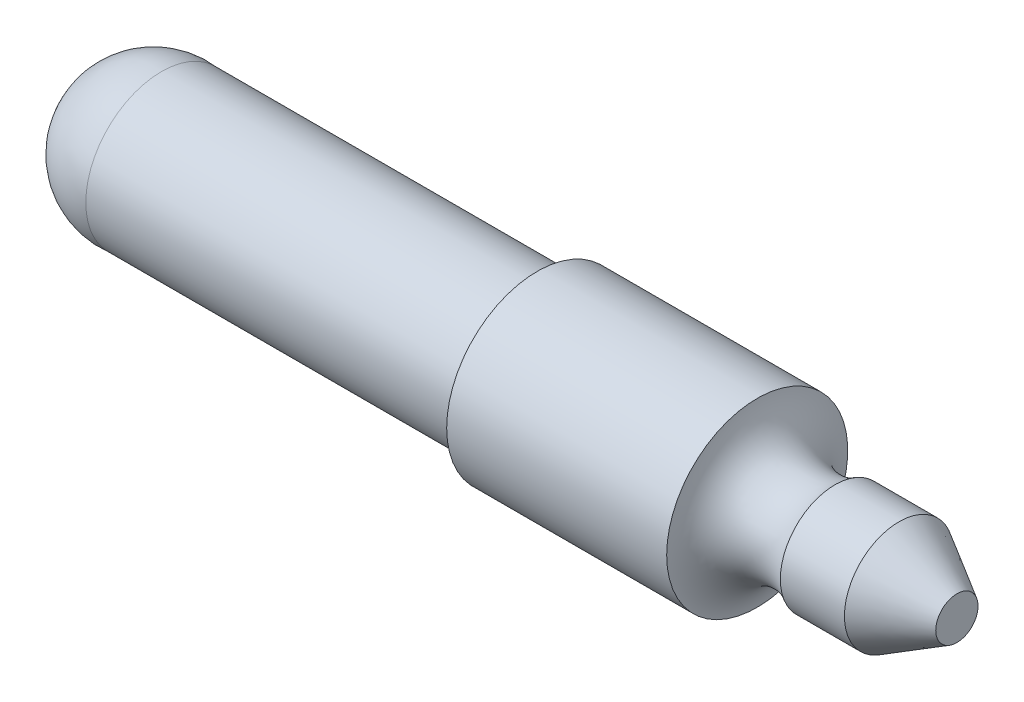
SolidWorks part; units mm, degrees
ref_plane "Front Plane" through (0, 0, 0) normal (0, 0, 1) x (1, 0, 0)
ref_plane "Top Plane" through (0, 0, 0) normal (0, 1, 0) x (1, 0, 0)
ref_plane "Right Plane" through (0, 0, 0) normal (1, 0, 0) x (0, 0, -1)
sketch "Sketch2" plane through (0, 0, 0) normal (0, 0, 1) x (1, 0, 0)
  line L0 (0, 0) -> (50000, 0) construction
  line L1 (0.1203, 1.1367) -> (5.7591, 1.1366)
  line L2 (5.7591, 1.1366) -> (5.7591, 1.3589)
  line L3 (5.7591, 1.3589) -> (9.0611, 1.3589)
  line L4 (10.2278, 0.8192) -> (11.1894, 0.8192)
  line L5 (11.1894, 0.8192) -> (12.0583, 0.3175)
  line L6 (12.0583, 0.3175) -> (12.0583, 0)
  line L7 (12.0583, 0) -> (-1.143, 0)
  arc A0 (-1.143, 0) -> (0.1203, 1.1367) centre (0, 0) cw
  arc A1 (9.0611, 1.3589) -> (10.2278, 0.8192) centre (9.8163, 1.4605) ccw
  dimension "D1" = 1.143
  dimension "D2" = 0.762
  dimension "D3" = 0.3175
  dimension "D4" = 1.6383
  dimension "D5" = 2.921
  dimension "D6" = 2.7178
  dimension "D7" = 2.2733
  dimension "D8" = 11.938
  dimension "D9" = 5.6388
  dimension "D10" = 3.302
  dimension "D11" = 30
revolve "Revolve1" add sketch "Sketch2" angle 360 about L0
